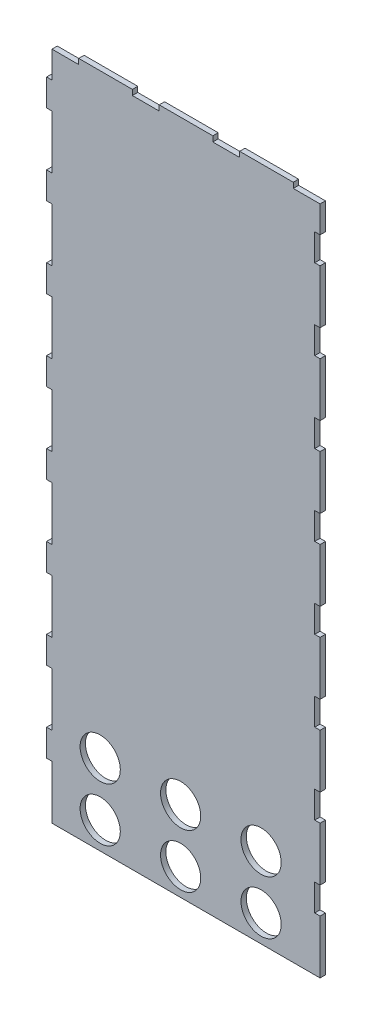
SolidWorks part; units mm, degrees
ref_plane "Front Plane" through (0, 0, 0) normal (0, 0, 1) x (1, 0, 0)
ref_plane "Top Plane" through (0, 0, 0) normal (0, 1, 0) x (1, 0, 0)
ref_plane "Right Plane" through (0, 0, 0) normal (1, 0, 0) x (0, 0, -1)
sketch "Sketch1" plane through (0, 0, 0) normal (0, 0, 1) x (1, 0, 0)
  line L1 (-50, 125) -> (50, 125)
  line L2 (-50, 125) -> (-50, -125)
  line L3 (-50, -125) -> (50, -125)
  line L4 (50, 125) -> (50, -125)
  line L5 (-50, 125) -> (50, -125) construction
  line L6 (-50, -125) -> (50, 125) construction
  circle A1 centre (-32, -95) radius 7.5
  circle A2 centre (-2, -95) radius 7.5
  circle A3 centre (28, -95) radius 7.5
  circle A4 centre (-2, -115) radius 7.5
  circle A5 centre (28, -115) radius 7.5
  circle A6 centre (-32, -115) radius 7.5
  point P0 (0, 0)
extrude "Boss-Extrude1" add sketch "Sketch1" along normal blind 2 contours L2 L3 L4 L1
sketch "Sketch3" plane through (-50, 0, 0) normal (-1, 0, 0) x (0, 0, 1)
  line L0 (2, 125) -> (2, -125) construction
  line L1 (2, 115) -> (0, 115)
  line L2 (2, 115) -> (2, 105)
  line L3 (2, 105) -> (0, 105)
  line L4 (0, 115) -> (0, 105)
  line L5 (0, 125) -> (0, -125) construction
  line L6 (2, 125) -> (0, 125) construction
  dimension "D1" = 10
  dimension "D2" = 10
extrude "Boss-Extrude2" add sketch "Sketch3" along normal blind 2
pattern_linear "LPattern1" count 8 spacing 30 along (0, -1, 0) of "Boss-Extrude2"
sketch "Sketch4" plane through (50, 0, 0) normal (1, 0, 0) x (0, 0, -1)
  line L0 (-2, -95) -> (0, -95) construction
  line L1 (0, -95) -> (0, -105) construction
  line L2 (0, -105) -> (-2, -105) construction
  line L3 (-2, -105) -> (-2, -95) construction
  line L4 (0, -125) -> (0, 125)
  line L5 (0, 125) -> (-2, 125)
  line L6 (-2, 125) -> (-2, -125)
  line L7 (-2, -125) -> (0, -125)
  line L8 (0, -125) -> (0, 125)
  line L9 (0, 125) -> (-2, 125)
  line L10 (-2, 125) -> (-2, -125)
  line L11 (-2, -125) -> (0, -125)
  line L12 (-2, -65) -> (0, -65) construction
  line L13 (0, -75) -> (-2, -75) construction
  line L14 (-2, -75) -> (-2, -65) construction
  line L15 (0, -65) -> (0, -75) construction
  line L16 (-2, -35) -> (0, -35) construction
  line L17 (0, -45) -> (-2, -45) construction
  line L18 (-2, -45) -> (-2, -35) construction
  line L19 (0, -35) -> (0, -45) construction
  line L20 (-2, -5) -> (0, -5) construction
  line L21 (0, -15) -> (-2, -15) construction
  line L22 (-2, -15) -> (-2, -5) construction
  line L23 (0, -5) -> (0, -15) construction
  line L24 (-2, 25) -> (0, 25) construction
  line L25 (-2, 15) -> (-2, 25) construction
  line L26 (0, 25) -> (0, 15) construction
  line L27 (0, 15) -> (-2, 15) construction
  line L28 (-2, 55) -> (0, 55) construction
  line L29 (0, 45) -> (-2, 45) construction
  line L30 (-2, 45) -> (-2, 55) construction
  line L31 (0, 55) -> (0, 45) construction
  line L32 (0, 75) -> (-2, 75) construction
  line L33 (-2, 75) -> (-2, 85) construction
  line L34 (0, 85) -> (0, 75) construction
  line L35 (-2, 85) -> (0, 85) construction
  line L36 (0, 105) -> (-2, 105) construction
  line L37 (-2, 115) -> (0, 115) construction
  line L38 (0, 115) -> (0, 105) construction
  line L39 (-2, 105) -> (-2, 115) construction
  line L40 (-2, -95) -> (0, -95)
  line L41 (0, -95) -> (0, -105)
  line L42 (0, -105) -> (-2, -105)
  line L43 (-2, -105) -> (-2, -95)
  line L44 (-2, -65) -> (0, -65)
  line L45 (0, -75) -> (-2, -75)
  line L46 (-2, -75) -> (-2, -65)
  line L47 (0, -65) -> (0, -75)
  line L48 (-2, -35) -> (0, -35)
  line L49 (0, -45) -> (-2, -45)
  line L50 (-2, -45) -> (-2, -35)
  line L51 (0, -35) -> (0, -45)
  line L52 (-2, -5) -> (0, -5)
  line L53 (0, -15) -> (-2, -15)
  line L54 (-2, -15) -> (-2, -5)
  line L55 (0, -5) -> (0, -15)
  line L56 (-2, 25) -> (0, 25)
  line L57 (-2, 15) -> (-2, 25)
  line L58 (0, 25) -> (0, 15)
  line L59 (0, 15) -> (-2, 15)
  line L60 (-2, 55) -> (0, 55)
  line L61 (0, 45) -> (-2, 45)
  line L62 (-2, 45) -> (-2, 55)
  line L63 (0, 55) -> (0, 45)
  line L64 (0, 75) -> (-2, 75)
  line L65 (-2, 75) -> (-2, 85)
  line L66 (0, 85) -> (0, 75)
  line L67 (-2, 85) -> (0, 85)
  line L68 (0, 105) -> (-2, 105)
  line L69 (-2, 115) -> (0, 115)
  line L70 (0, 115) -> (0, 105)
  line L71 (-2, 105) -> (-2, 115)
  dimension "D1" = 0
extrude "Cut-Extrude4" cut sketch "Sketch4" against normal blind 2 contours L45 L44 L10 M5 | L49 L8 L48 L10 | L53 L52 L10 M5 | L59 L8 L56 L10 | L61 L60 L10 M5 | L67 L10 L64 L8 | L69 L10 L68 L8 | L42 L43 L40 L41
sketch "Sketch5" plane through (0, 125, 0) normal (0, 1, 0) x (1, 0, 0)
  line L0 (50, 0) -> (-50, 0) construction
  line L1 (-40, 0) -> (-20, 0)
  line L2 (-40, 0) -> (-40, -2)
  line L3 (-40, -2) -> (-20, -2)
  line L4 (-20, 0) -> (-20, -2)
  line L5 (50, -2) -> (-50, -2) construction
  line L6 (-50, -2) -> (-50, 0) construction
  point P10 (-50, -1)
  dimension "D1" = 10
  dimension "D2" = 20
extrude "Boss-Extrude3" add sketch "Sketch5" along normal blind 2
pattern_linear "LPattern2" count 3 spacing 30 along (1, 0, 0) of "Boss-Extrude3"
equation "\"anch\" = 2"
equation "\"alt\" = 100"
equation "\"pilanch\" = 100"
equation "\"D1@Sketch1\"=\"pilanch\""
equation "\"pilalt\" = 250"
equation "\"D2@Sketch1\"=\"pilalt\""
equation "\"D1@Boss-Extrude1\"=\"anch\""
equation "\"D1@Boss-Extrude2\"=\"anch\""
equation "\"D1@Boss-Extrude3\"=\"anch\""
